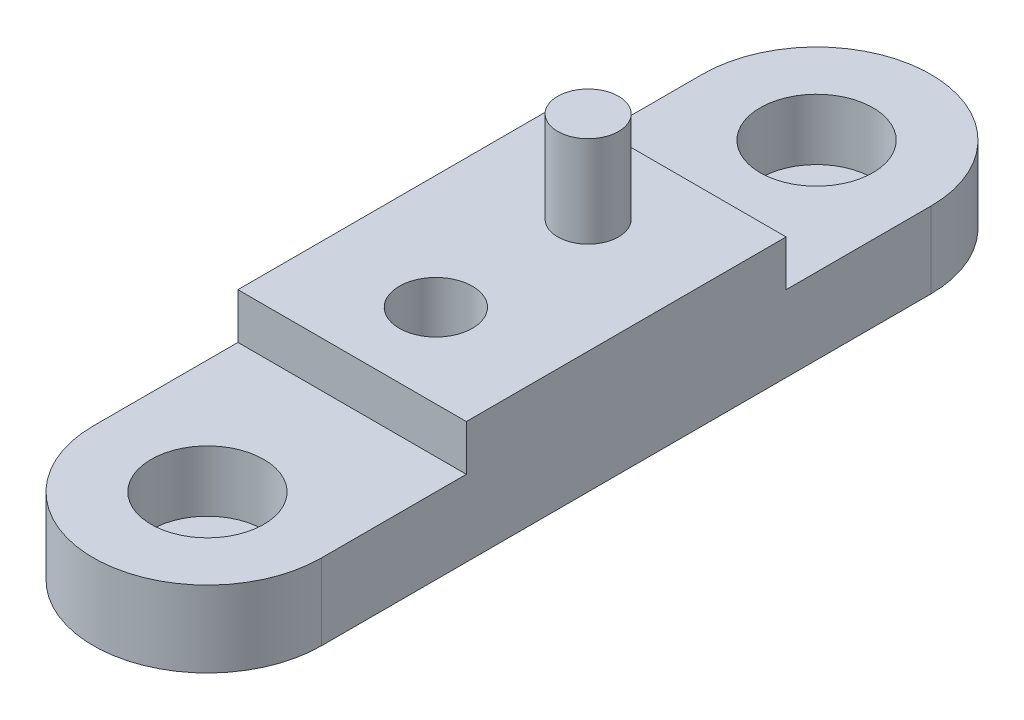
SolidWorks part; units mm, degrees
ref_plane "Front" through (0, 0, 0) normal (0, 0, 1) x (1, 0, 0)
ref_plane "Top" through (0, 0, 0) normal (0, 1, 0) x (1, 0, 0)
ref_plane "Right" through (0, 0, 0) normal (1, 0, 0) x (0, 0, -1)
sketch "Sketch1" plane through (0, 0, 0) normal (0, 1, 0) x (1, 0, 0)
  line L0 (0, 1.75) -> (-8.1896, 1.75) construction
  line L1 (0, 3.75) -> (-8.1896, 3.75) construction
  line L2 (-3.75, -10) -> (3.75, -10)
  line L3 (-3.75, 0) -> (3.75, 0) construction
  line L4 (-3.75, 0) -> (-3.75, -10)
  line L6 (3.75, 0) -> (3.75, -10)
  circle A0 centre (0, 0) radius 1.75 construction
  arc A1 (3.75, 0) -> (-3.75, 0) centre (0, 0) ccw
  dimension "D1" = 3.5
  dimension "D2" = 2
  dimension "D3" = 10
extrude "Boss-Extrude1" add sketch "Sketch1" along normal blind 4
sketch "Sketch2" plane through (0, 4, 0) normal (0, 1, 0) x (1, 0, 0)
  line L0 (0, 0) -> (-11.0692, 0) construction
  line L1 (-3.75, -4.75) -> (3.75, -4.75)
  line L2 (-3.75, 0) -> (-3.75, -10) construction
  line L3 (3.75, -10) -> (3.75, 0) construction
  line L4 (-3.75, 0) -> (-3.75, -4.75)
  line L5 (3.75, 0) -> (3.75, -4.75)
  line L6 (0, -3.75) -> (-8.4344, -3.75) construction
  arc A0 (3.75, 0) -> (-3.75, 0) centre (0, 0) ccw construction
  arc A1 (3.75, 0) -> (-3.75, 0) centre (0, 0) ccw
  circle A2 centre (0, 0) radius 3.75 construction
  dimension "D1" = 1
extrude "Cut-Extrude1" cut sketch "Sketch2" against normal blind 1.5
sketch "Sketch3" plane through (0, 2.5, 0) normal (0, 1, 0) x (1, 0, 0)
  circle A0 centre (0, 0) radius 1.85
  dimension "D1" = 3.7
extrude "Cut-Extrude2" cut sketch "Sketch3" against normal blind 2
mirror "Mirror1" about plane through (-3.75, 4, 10) normal (0, 0, -1)
sketch "Sketch4" plane through (0, 4, 0) normal (0, 1, 0) x (1, 0, 0)
  line L0 (0, -4.75) -> (0, -15.25) construction
  line L1 (-3.75, -4.75) -> (3.75, -4.75) construction
  line L2 (-3.75, -15.25) -> (3.75, -15.25) construction
  line L3 (0, -10) -> (-6.044, -10) construction
  circle A0 centre (0, -7.5) radius 1
  dimension "D2" = 2
  dimension "D1" = 2.5
extrude "Boss-Extrude2" add sketch "Sketch4" along normal blind 3
sketch "Sketch5" plane through (0, 4, 0) normal (0, 1, 0) x (1, 0, 0)
  line L0 (0, -4.75) -> (0, -15.25) construction
  line L1 (-3.75, -4.75) -> (3.75, -4.75) construction
  line L2 (-3.75, -15.25) -> (3.75, -15.25) construction
  line L3 (0, -10) -> (-7.1463, -10) construction
  circle A0 centre (0, -12.5) radius 1.2
  dimension "D2" = 2.4
  dimension "D1" = 2.5
extrude "Cut-Extrude3" cut sketch "Sketch5" against normal blind 4
